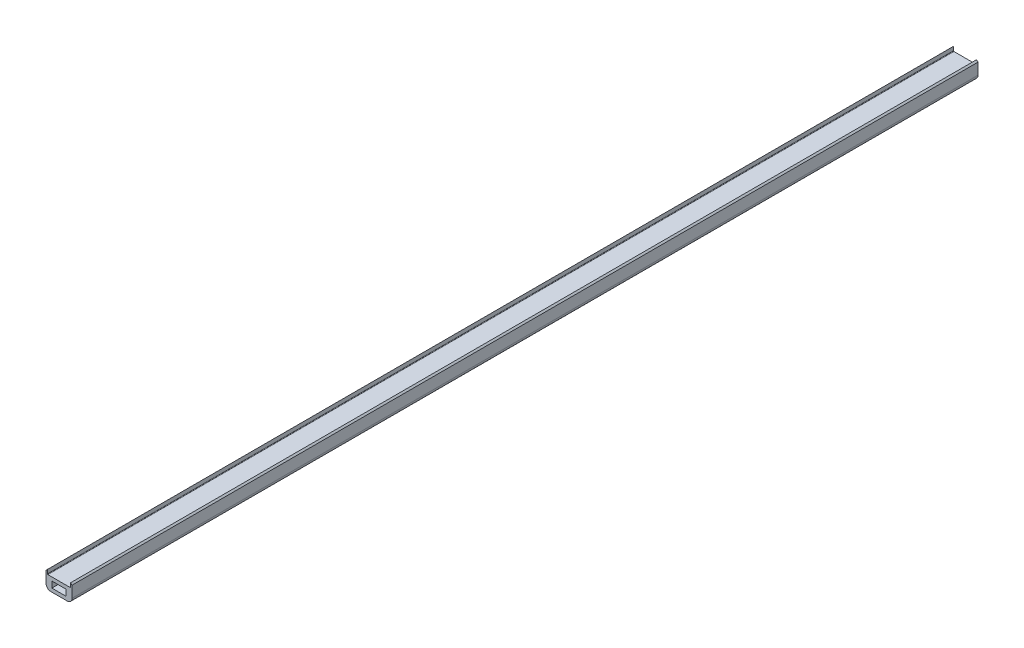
SolidWorks part; units mm, degrees
other "<Rubber Moulding_02>-<Cut-Extrude1>"
ref_plane "Front Plane" through (0, 0, 0) normal (0, 0, 1) x (1, 0, 0)
ref_plane "Top Plane" through (0, 0, 0) normal (0, 1, 0) x (1, 0, 0)
ref_plane "Right Plane" through (0, 0, 0) normal (1, 0, 0) x (0, 0, -1)
mirrored part "Rubber Moulding_02_Mirrored"
